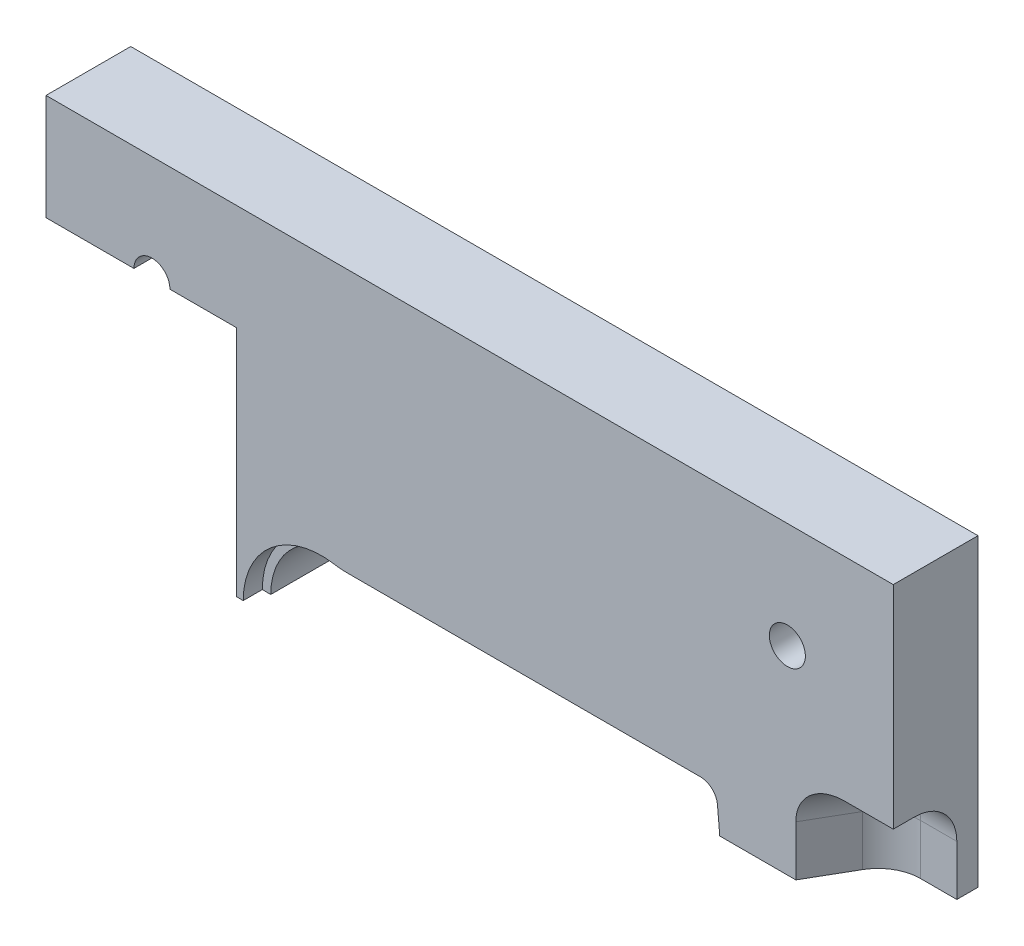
SolidWorks part; units mm, degrees
ref_plane "Plan1" through (0, 0, 0) normal (0, 0, 1) x (1, 0, 0)
ref_plane "Plan2" through (0, 0, 0) normal (0, 1, 0) x (1, 0, 0)
ref_plane "Plan3" through (0, 0, 0) normal (1, 0, 0) x (0, 0, -1)
sketch "Esquisse1" plane through (0, 0, 0) normal (0, 0, 1) x (1, 0, 0)
  line L1 (0, 0) -> (200, 0)
  line L2 (0, 0) -> (0, 150)
  line L3 (0, 150) -> (200, 150)
  line L4 (200, 0) -> (200, 150)
  dimension "D1" = 150
  dimension "D2" = 200
extrude "Base-Extrusion" add sketch "Esquisse1" along normal blind 20
sketch "Esquisse2" plane through (0, 0, 20) normal (0, 0, 1) x (1, 0, 0)
  line L0 (-10, 70) -> (90, 70) construction
  line L1 (0, 0) -> (200, 0) construction
  line L2 (20.3045, 78.12) -> (209.4484, 78.12) construction
  line L3 (71.0782, 85.935) -> (154.4898, 85.935)
  line L4 (156.5121, 84.0819) -> (157.0337, 78.12)
  line L5 (156.5121, 72.1581) -> (157.0337, 78.12)
  line L6 (95.6814, 70.305) -> (154.4898, 70.305)
  line L7 (200, 0) -> (200, 150) construction
  arc A0 (67.7404, 86.2151) -> (78.8329, 61.1069) centre (65, 70) ccw
  arc A1 (154.4898, 85.935) -> (156.5121, 84.0819) centre (154.4898, 83.905) cw
  arc A2 (71.0782, 85.935) -> (67.7404, 86.2151) centre (71.0782, 105.965) cw
  arc A3 (154.4898, 70.305) -> (156.5121, 72.1581) centre (154.4898, 72.335) ccw
  arc A4 (95.6814, 70.305) -> (78.8329, 61.1069) centre (95.6814, 50.275) ccw
  point P13 (156.35, 85.935)
  dimension "D2" = 32.89
  dimension "D6" = 91.35
  dimension "D7" = 2.03
  dimension "D8" = 20.03
  dimension "D9" = 20.03
  dimension "D10" = 135
  dimension "D1" = 70
  dimension "D3" = 8.12
  dimension "D4" = 7.815
  dimension "D5" = 95
extrude "Enlèv. mat.-Extru.1" cut sketch "Esquisse2" against normal through all
sketch "Esquisse10" plane through (0, 0, 20) normal (0, 0, 1) x (1, 0, 0)
  line L8 (158.5045, 71.9838) -> (159.0414, 78.12)
  line L9 (95.6814, 68.305) -> (154.4898, 68.305)
  line L10 (159.0414, 78.12) -> (158.5045, 84.2562)
  line L11 (154.4898, 87.935) -> (71.0782, 87.935)
  line L12 (158.5045, 71.9838) -> (159.0414, 78.12)
  line L13 (95.6814, 68.305) -> (154.4898, 68.305)
  line L14 (159.0414, 78.12) -> (158.5045, 84.2562)
  line L15 (154.4898, 87.935) -> (71.0782, 87.935)
  arc A10 (154.4898, 68.305) -> (158.5045, 71.9838) centre (154.4898, 72.335) ccw
  arc A11 (95.6814, 68.305) -> (80.5153, 60.0253) centre (95.6814, 50.275) ccw
  arc A12 (68.0737, 88.1871) -> (80.5153, 60.0253) centre (65, 70) ccw
  arc A13 (68.0737, 88.1871) -> (71.0782, 87.935) centre (71.0782, 105.965) ccw
  arc A14 (158.5045, 84.2562) -> (154.4898, 87.935) centre (154.4898, 83.905) ccw
  arc A15 (154.4898, 68.305) -> (158.5045, 71.9838) centre (154.4898, 72.335) ccw
  arc A16 (95.6814, 68.305) -> (80.5153, 60.0253) centre (95.6814, 50.275) ccw
  arc A17 (68.0737, 88.1871) -> (80.5153, 60.0253) centre (65, 70) ccw
  arc A18 (68.0737, 88.1871) -> (71.0782, 87.935) centre (71.0782, 105.965) ccw
  arc A19 (158.5045, 84.2562) -> (154.4898, 87.935) centre (154.4898, 83.905) ccw
  dimension "D1" = 2
extrude "Enlèv. mat.-Extru.9" cut sketch "Esquisse10" against normal blind 4.5
hole_wizard "Trou taraudé M10x1.52" positions "Esquisse15" profile "Esquisse14" tap size "M10x1.5" standard "ISO"
sketch "Esquisse15" plane through (0, 0, 20) normal (0, 0, 1) x (1, 0, 0)
  line L0 (0, 0) -> (200, 0) construction
  line L1 (200, 0) -> (200, 150) construction
  line L2 (200, 150) -> (0, 150) construction
  point P0 (175, 125)
  point P1 (25, 125)
  point P2 (25, 25)
  point P3 (175, 25)
  dimension "D1" = 100
  dimension "D2" = 25
  dimension "D3" = 150
  dimension "D4" = 150
  dimension "D5" = 100
  dimension "D6" = 25
  dimension "D7" = 25
  dimension "D8" = 25
sketch "Esquisse14" plane through (175, 125, 20) normal (1, 0, 0) x (0, -1, 0)
  line L0 (0, 0) -> (0, 20)
  line L1 (0, 20) -> (4.25, 20)
  line L2 (4.25, 20) -> (4.25, 0)
  line L5 (4.25, 0) -> (0, 0)
  line L11 (0, -6.35) -> (0, 107.95) construction
  dimension "Diamètre du perçage jusqu'au prochain" = 8.5
  dimension "Profondeur du perçage jusqu'au prochain" = 20
sketch "Esquisse16" plane through (0, 0, 0) normal (0, 0, -1) x (-1, 0, 0)
  circle A0 centre (-25, 125) radius 13
  circle A1 centre (-25, 25) radius 13
  circle A2 centre (-175, 25) radius 13
  circle A3 centre (-175, 125) radius 13
  dimension "D1" = 26
  dimension "D2" = 26
  dimension "D3" = 26
  dimension "D4" = 26
extrude "Enlèv. mat.-Extru.10" cut sketch "Esquisse16" against normal blind 5
sketch "Esquisse17" plane through (0, 0, 20) normal (0, 0, 1) x (1, 0, 0)
  line L0 (200, 0) -> (200, 150) construction
  line L1 (200, 100) -> (177, 100)
  line L2 (200, 100) -> (200, 50)
  line L3 (200, 50) -> (177, 50)
  line L4 (177, 100) -> (177, 50)
  line L5 (0, 0) -> (200, 0) construction
  dimension "D1" = 50
  dimension "D2" = 50
  dimension "D3" = 23
extrude "Enlèv. mat.-Extru.11" cut sketch "Esquisse17" against normal blind 15
draft "Dépouille1" type of draft neutral plane draft angle 30 faces to draft 1 parameters "D1"=30
fillet "Congé1" radius 10
sketch "Esquisse18" plane through (0, 0, 20) normal (0, 0, 1) x (1, 0, 0)
  line L0 (-8.1721, 125) -> (45, 125)
  line L1 (45, 125) -> (45, 70)
  line L2 (65, 70) -> (45, 70)
  line L3 (65, 70) -> (82.4134, 78.12)
  line L4 (82.4134, 78.12) -> (212.9104, 78.12)
  line L5 (0, 150) -> (0, 0) construction
  dimension "D1" = 45
  dimension "D2" = 25
  dimension "D3" = 8.12
extrude "Enlèv. mat.-Extru.12" cut sketch "Esquisse18" against normal through all and the other way through all flip side to cut
